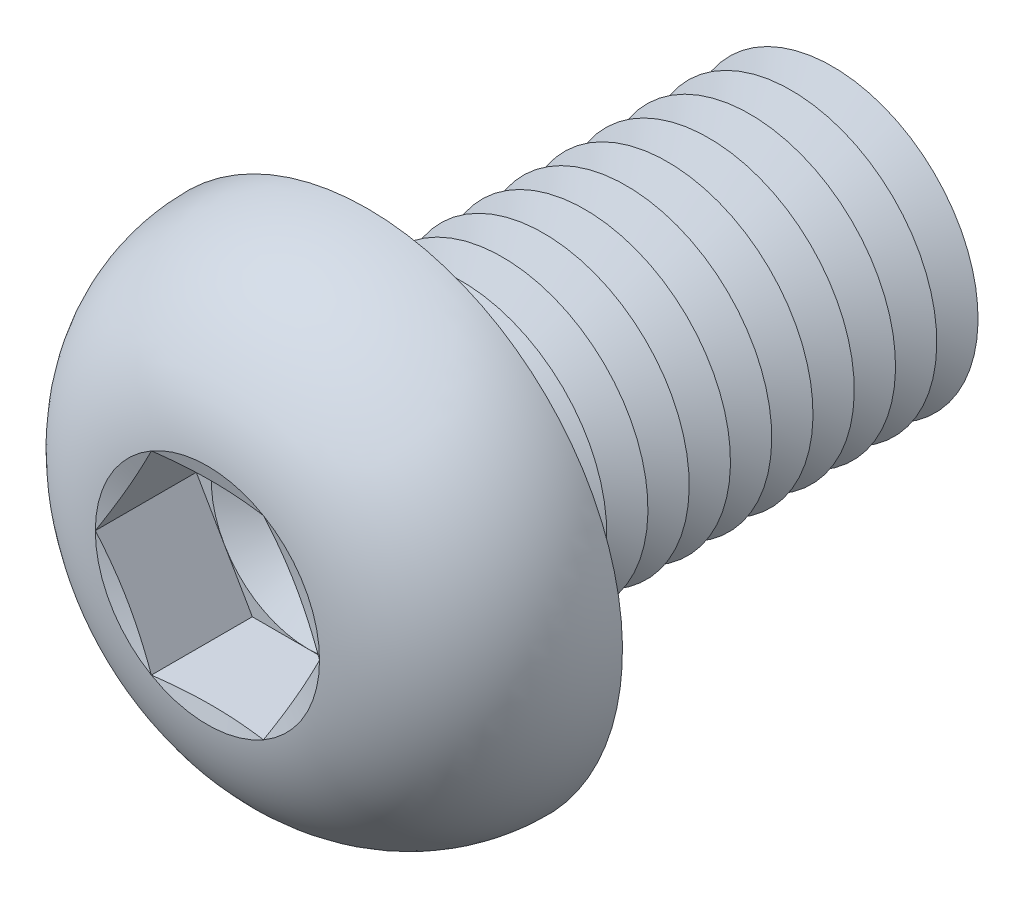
SolidWorks part; units mm, degrees
ref_plane "Front Plane" through (0, 0, 0) normal (0, 0, 1) x (1, 0, 0)
ref_plane "Top Plane" through (0, 0, 0) normal (0, 1, 0) x (1, 0, 0)
ref_plane "Right Plane" through (0, 0, 0) normal (1, 0, 0) x (0, 0, -1)
sketch "Sketch1" plane through (0, 0, 0) normal (1, 0, 0) x (0, 0, -1)
  line L0 (0, 6) -> (0, 10.5)
  line L3 (0, 6) -> (20, 6)
  line L4 (20, 6) -> (20, 0)
  line L5 (20, 0) -> (-6.6, 0) construction
  line L6 (-6.6, 0) -> (20, 0)
  line L7 (-6.6, 4.6188) -> (-6.6, 2.3094) construction
  line L8 (-6.6, 2.3094) -> (-6.6, 0)
  line L9 (-6.6, 4.6188) -> (-5.9812, 2.3094)
  line L10 (-5.9812, 2.3094) -> (-6.6, 2.3094)
  line L11 (20, 0) -> (22.7481, 0) construction
  line L12 (0, 10.5) -> (-6.6, 10.5) construction
  arc A1 (0, 10.5) -> (-6.6, 4.6188) centre (0, 3.8561) ccw
  point P8 (20, 3)
  dimension "D1" = 21
  dimension "D2" = 12
  dimension "D3" = 6.6
  dimension "D4" = 9.2376
  dimension "D5" = 20
  dimension "D6" = 15
revolve "Revolve1" add sketch "Sketch1" angle 360 about L5
fillet "Fillet1" radius 0.85 1 edges at (0, 6, 0)
sketch "Sketch2" plane through (0, 0, 0) normal (1, 0, 0) x (0, 0, -1)
  line L0 (19.15, 6) -> (20.85, 6)
  line L1 (20, 6) -> (0.85, 6) construction
  line L2 (20.85, 6) -> (20, 4.5278)
  line L3 (20, -6) -> (20, 6) construction
  line L4 (20, 4.5278) -> (19.15, 6)
  dimension "D1" = 1.7
revolve "Cut-Revolve1" cut sketch "Sketch2" angle 360 about axis through (0, 0, -20) along (0, 0, -1)
pattern_linear "LPattern1" count 11 spacing 1.7 along (0, 0, 1) of "Cut-Revolve1"
sketch "Sketch3" plane through (0, 0, 6.6) normal (0, 0, 1) x (1, 0, 0)
  line L7 (2.3094, 4) -> (-2.3094, 4)
  line L8 (-2.3094, 4) -> (-4.6188, 0)
  line L9 (-4.6188, 0) -> (-2.3094, -4)
  line L10 (-2.3094, -4) -> (2.3094, -4)
  line L11 (2.3094, -4) -> (4.6188, 0)
  line L12 (4.6188, 0) -> (2.3094, 4)
  circle A0 centre (0, 0) radius 4 construction
  circle A3 centre (0, 0) radius 4.6188 construction
extrude "Cut-Extrude1" cut sketch "Sketch3" against normal blind 4.16
sketch "Sketch4" plane through (0, 0, 2.44) normal (0, 0, 1) x (1, 0, 0)
  line L1 (2.3094, 4) -> (-2.3094, 4) construction
  circle A0 centre (0, 0) radius 4
extrude "Cut-Extrude2" cut sketch "Sketch4" against normal through all draft 60
